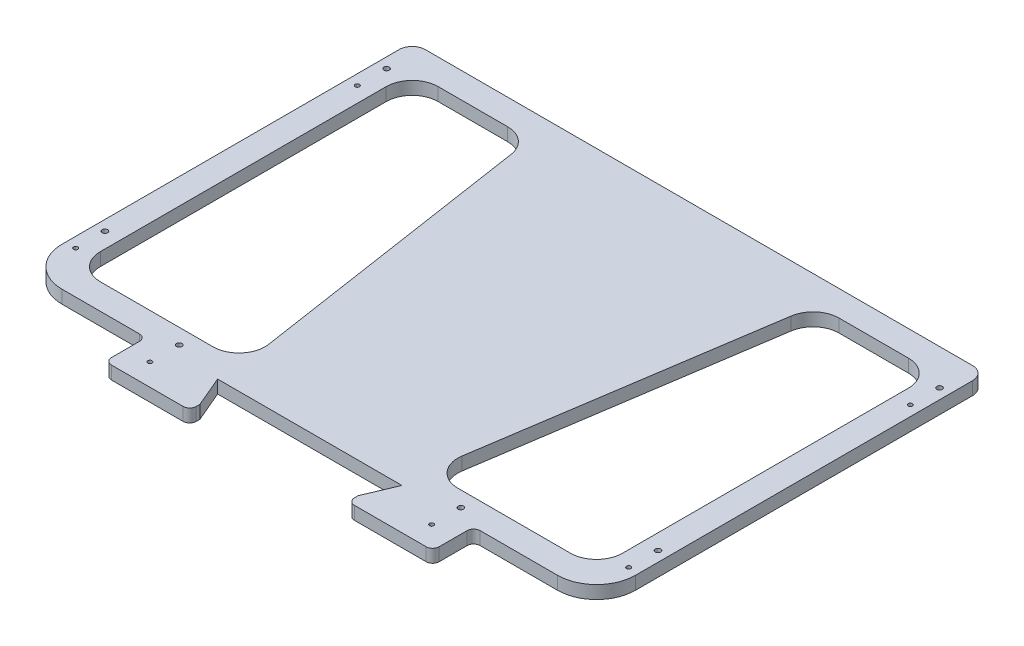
SolidWorks part; units mm, degrees
ref_plane "Front Plane" through (0, 0, 0) normal (0, 0, 1) x (1, 0, 0)
ref_plane "Top Plane" through (0, 0, 0) normal (0, 1, 0) x (1, 0, 0)
ref_plane "Right Plane" through (0, 0, 0) normal (1, 0, 0) x (0, 0, -1)
sketch "Sketch1" plane through (0, 0, 0) normal (0, 1, 0) x (1, 0, 0)
  line L1 (0, 0) -> (560, 0)
  line L2 (0, 0) -> (0, 380)
  line L3 (0, 380) -> (560, 380)
  line L4 (560, 0) -> (560, 380)
  dimension "D1" = 380
  dimension "D2" = 560
extrude "Boss-Extrude1" add sketch "Sketch1" along normal blind 12.7
fillet "Fillet1" radius 38.1 2 edges at (560, 6.35, 0) (0, 6.35, 0)
hole_wizard "M5 Clearance Hole1" positions "Sketch3" profile "Sketch2" hole size "M5" standard "ANSI Metric"
sketch "Sketch3" plane through (0, 12.7, 0) normal (0, 1, 0) x (1, 0, 0)
  line L0 (38.1, 0) -> (521.9, 0) construction
  point P0 (142.5, 10)
  point P2 (417.5, 10)
  point P5 (280, 0)
  dimension "D1" = 275
  dimension "D2" = 137.5
  dimension "D3" = 10
  dimension "D4" = 10
sketch "Sketch2" plane through (142.5, 12.7, -10) normal (1, 0, 0) x (0, 0, 1)
  line L0 (0, 0) -> (0, 12.7)
  line L1 (0, 12.7) -> (2.65, 12.7)
  line L2 (2.65, 12.7) -> (2.65, 0)
  line L5 (2.65, 0) -> (0, 0)
  line L11 (0, -6.35) -> (0, 107.95) construction
  dimension "Thru Hole Dia." = 5.3
  dimension "Thru Hole Depth" = 12.7
hole_wizard "M5 Clearance Hole2" positions "Sketch5" profile "Sketch4" hole size "M5" standard "ANSI Metric"
sketch "Sketch5" plane through (0, 12.7, 0) normal (0, 1, 0) x (1, 0, 0)
  line L0 (38.1, 0) -> (521.9, 0) construction
  line L3 (560, 380) -> (0, 380) construction
  point P0 (10, 70)
  point P2 (10, 345)
  point P4 (550, 345)
  point P6 (550, 70)
  point P15 (280, 0)
  point P16 (280, 380)
  dimension "D1" = 70
  dimension "D2" = 275
  dimension "D3" = 540
  dimension "D4" = 70
  dimension "D5" = 275
  dimension "D6" = 270
  dimension "D7" = 540
  dimension "D8" = 270
sketch "Sketch4" plane through (10, 12.7, -70) normal (1, 0, 0) x (0, 0, 1)
  line L0 (0, 0) -> (0, 12.7)
  line L1 (0, 12.7) -> (2.65, 12.7)
  line L2 (2.65, 12.7) -> (2.65, 0)
  line L5 (2.65, 0) -> (0, 0)
  line L11 (0, -6.35) -> (0, 107.95) construction
  dimension "Thru Hole Dia." = 5.3
  dimension "Thru Hole Depth" = 12.7
sketch "Sketch6" plane through (0, 12.7, 0) normal (0, 1, 0) x (1, 0, 0)
  line L0 (25, 329.6) -> (25, 50.4)
  line L1 (50.4, 25) -> (160.4616, 25)
  line L2 (185.575, 54.2051) -> (143.272, 333.4051)
  line L3 (118.1586, 355) -> (50.4, 355)
  line L4 (280, 380) -> (280, 0) construction
  line L5 (560, 380) -> (0, 380) construction
  line L6 (38.1, 0) -> (521.9, 0) construction
  line L7 (0, 380) -> (0, 38.1) construction
  line L8 (441.8414, 355) -> (509.6, 355)
  line L9 (374.425, 54.2051) -> (416.728, 333.4051)
  line L10 (509.6, 25) -> (399.5384, 25)
  line L11 (535, 329.6) -> (535, 50.4)
  arc A0 (143.272, 333.4051) -> (118.1586, 355) centre (118.1586, 329.6) ccw
  arc A1 (160.4616, 25) -> (185.575, 54.2051) centre (160.4616, 50.4) ccw
  arc A2 (25, 50.4) -> (50.4, 25) centre (50.4, 50.4) ccw
  arc A3 (25, 329.6) -> (50.4, 355) centre (50.4, 329.6) cw
  arc A4 (535, 329.6) -> (509.6, 355) centre (509.6, 329.6) ccw
  arc A5 (535, 50.4) -> (509.6, 25) centre (509.6, 50.4) cw
  arc A6 (399.5384, 25) -> (374.425, 54.2051) centre (399.5384, 50.4) cw
  arc A7 (416.728, 333.4051) -> (441.8414, 355) centre (441.8414, 329.6) cw
  point P14 (140, 355)
  point P17 (190, 25)
  point P20 (25, 25)
  point P23 (25, 355)
  point P36 (535, 355)
  point P37 (535, 25)
  point P38 (370, 25)
  point P39 (420, 355)
  dimension "D6" = 25.4
  dimension "D1" = 25
  dimension "D2" = 25
  dimension "D3" = 25
  dimension "D4" = 165
  dimension "D5" = 115
extrude "Cut-Extrude1" cut sketch "Sketch6" against normal through all
fillet "Fillet2" radius 12.7 2 edges at (560, 6.35, -380) (0, 6.35, -380)
sketch "Sketch7" plane through (0, 0, 0) normal (0, 0, 1) x (1, 0, 0)
  line L0 (38.1, 12.7) -> (521.9, 12.7) construction
  line L1 (120, 12.7) -> (440, 12.7)
  line L2 (120, 12.7) -> (120, 0)
  line L3 (120, 0) -> (440, 0)
  line L4 (440, 12.7) -> (440, 0)
  line L5 (38.1, 0) -> (521.9, 0) construction
  line L6 (547.3, 12.7) -> (12.7, 12.7) construction
  point P8 (280, 12.7)
  point P11 (280, 12.7)
  dimension "D1" = 160
  dimension "D2" = 160
extrude "Boss-Extrude2" add sketch "Sketch7" along normal blind 40
fillet "Fillet3" radius 6.35 4 edges at (120, 6.35, 0) (440, 6.35, 0) (120, 6.35, 40) (440, 6.35, 40)
sketch "Sketch8" plane through (0, 12.7, 0) normal (0, 1, 0) x (1, 0, 0)
  line L0 (370, 0) -> (357.2658, -30)
  line L3 (202.7342, -30) -> (190, 0)
  line L4 (190, 0) -> (370, 0)
  line L5 (547.3, 380) -> (12.7, 380) construction
  line L6 (38.1, 0) -> (113.65, 0) construction
  line L7 (202.7342, -30) -> (202.7342, -40)
  line L8 (433.65, -40) -> (126.35, -40) construction
  line L9 (202.7342, -40) -> (357.2658, -40)
  line L10 (357.2658, -40) -> (357.2658, -30)
  point P4 (280, 380)
  point P9 (280, 380)
  dimension "D1" = 90
  dimension "D2" = 90
  dimension "D3" = 30
  dimension "D4" = 67
  dimension "D5" = 67
  dimension "D6" = 10
extrude "Cut-Extrude2" cut sketch "Sketch8" against normal up to next
hole_wizard "Ø4.2 (4.2) Diameter Hole1" positions "Sketch10" profile "Sketch9" hole size "Ø4.2" standard "ANSI Metric"
sketch "Sketch10" plane through (0, 12.7, 0) normal (0, 1, 0) x (1, 0, 0)
  line L0 (370, 0) -> (190, 0) construction
  circle A0 centre (10, 345) radius 2.65 construction
  circle A1 centre (550, 345) radius 2.65 construction
  circle A2 centre (550, 70) radius 2.65 construction
  circle A3 centre (417.5, 10) radius 2.65 construction
  circle A4 centre (142.5, 10) radius 2.65 construction
  circle A5 centre (10, 70) radius 2.65 construction
  point P0 (10, 316.425)
  point P2 (10, 41.425)
  point P4 (142.5, -18.575)
  point P6 (417.5, -18.575)
  point P8 (550, 41.425)
  point P10 (550, 316.425)
  point P25 (280, 0)
  point P28 (280, 0)
  point P29 (280, 0)
  dimension "D1" = 28.575
  dimension "D2" = 28.575
  dimension "D3" = 28.575
  dimension "D4" = 28.575
  dimension "D5" = 28.575
  dimension "D6" = 28.575
  dimension "D7" = 275
  dimension "D8" = 540
  dimension "D9" = 540
  dimension "D10" = 270
  dimension "D11" = 270
  dimension "D12" = 137.5
sketch "Sketch9" plane through (10, 12.7, -316.425) normal (1, 0, 0) x (0, 0, 1)
  line L0 (0, 0) -> (0, 12.7)
  line L1 (0, 12.7) -> (2.1, 12.7)
  line L2 (2.1, 12.7) -> (2.1, 0)
  line L5 (2.1, 0) -> (0, 0)
  line L11 (0, -6.35) -> (0, 107.95) construction
  dimension "Thru Hole Dia." = 4.2
  dimension "Thru Hole Depth" = 12.7
fillet "Fillet4" radius 6.35 2 edges at (357.2658, 6.35, 40) (202.7342, 6.35, 40)
